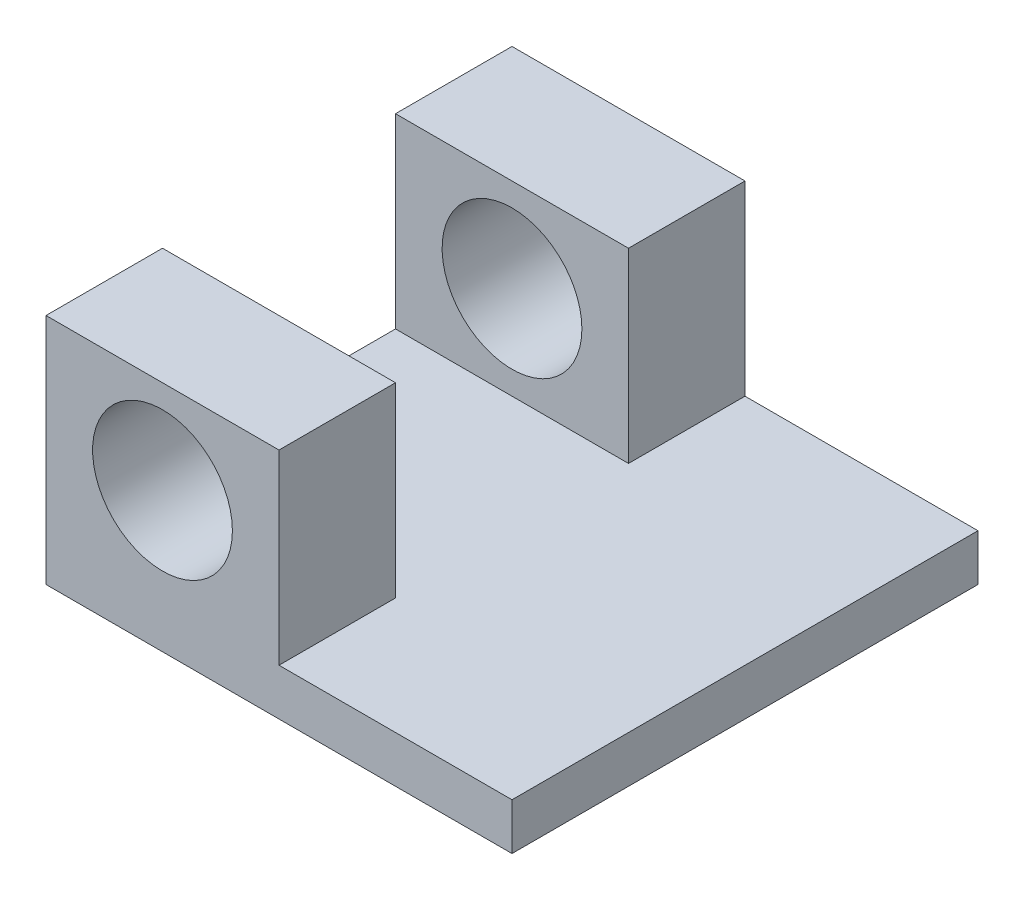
SolidWorks part; units mm, degrees
ref_plane "Front Plane" through (0, 0, 0) normal (0, 0, 1) x (1, 0, 0)
ref_plane "Top Plane" through (0, 0, 0) normal (0, 1, 0) x (1, 0, 0)
ref_plane "Right Plane" through (0, 0, 0) normal (1, 0, 0) x (0, 0, -1)
sketch "Sketch1" plane through (0, 0, 0) normal (0, 0, 1) x (1, 0, 0)
  line L1 (0, 0) -> (2.54, 0)
  line L2 (0, 0) -> (0, 1.27)
  line L3 (0, 1.27) -> (2.54, 1.27)
  line L4 (2.54, 0) -> (2.54, 1.27)
extrude "Extrude1" add sketch "Sketch1" along normal blind 2.54
sketch "Sketch2" plane through (0, 0, 2.54) normal (0, 0, 1) x (1, 0, 0)
  line L0 (1.27, 1.27) -> (1.27, 0.254)
  line L1 (2.54, 1.27) -> (0, 1.27) construction
  line L2 (1.27, 0.254) -> (2.54, 0.254)
  line L3 (2.54, 0) -> (2.54, 1.27) construction
extrude "Extrude2" cut sketch "Sketch2" against normal through all and the other way through all
sketch "Sketch3" plane through (0, 0, 2.54) normal (0, 0, 1) x (1, 0, 0)
  circle A0 centre (0.635, 0.762) radius 0.381
extrude "Extrude3" cut sketch "Sketch3" against normal through all
sketch "Sketch4" plane through (0, 0, 0) normal (-1, 0, 0) x (0, 0, 1)
  line L0 (1.905, 1.27) -> (1.905, 0.254)
  line L1 (2.54, 1.27) -> (0, 1.27) construction
  line L2 (1.905, 0.254) -> (0.635, 0.254)
  line L3 (0.635, 0.254) -> (0.635, 1.27)
  line L4 (2.54, 0) -> (0, 0) construction
  dimension "D1" = 1.27
  dimension "D2" = 0.635
  dimension "D3" = 0.254
extrude "Extrude5" cut sketch "Sketch4" against normal through all and the other way through all flip side to cut
